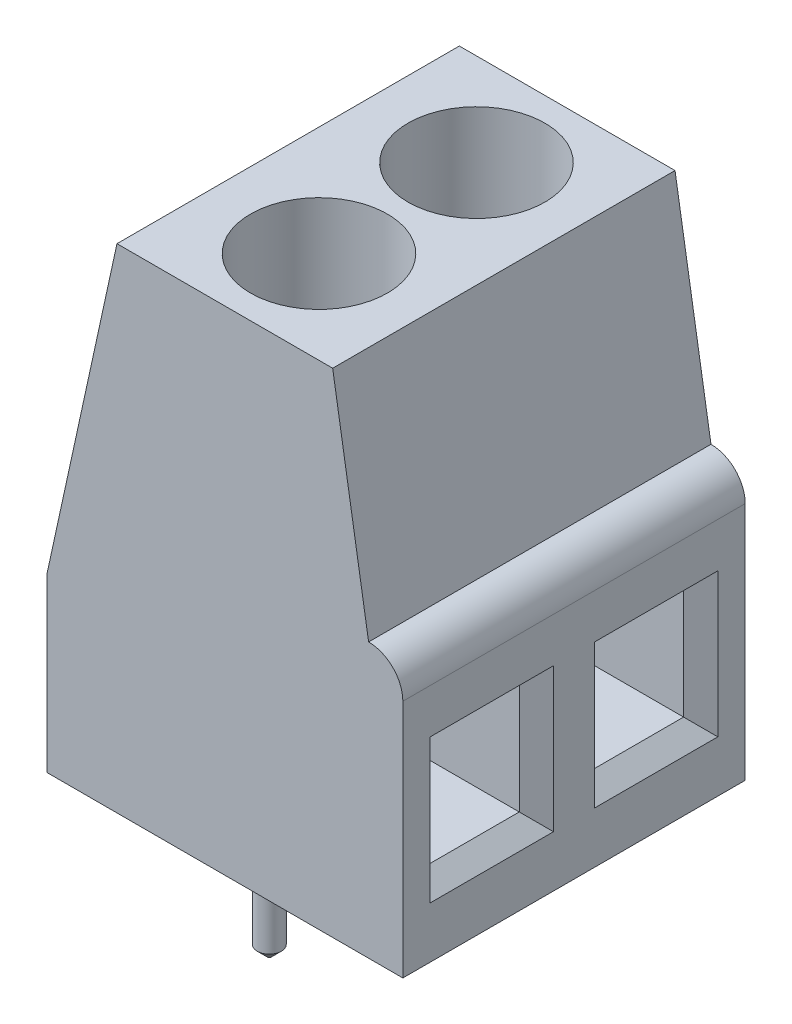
SolidWorks part; units mm, degrees
ref_plane "Plano frontal" through (0, 0, 0) normal (0, 0, 1) x (1, 0, 0)
ref_plane "Plano superior" through (0, 0, 0) normal (0, 1, 0) x (1, 0, 0)
ref_plane "Plano direito" through (0, 0, 0) normal (1, 0, 0) x (0, 0, -1)
sketch "Esboço2" plane through (0, 0, 0) normal (0, 0, 1) x (1, 0, 0)
  line L0 (0, 0) -> (10.4, 0)
  line L2 (0, 0) -> (0, 5)
  line L3 (10.4, 0) -> (10.4, 7)
  line L4 (5.2, 14.4) -> (8.35, 14.4)
  line L5 (2.05, 14.4) -> (0, 5)
  line L7 (5.2, 14.4) -> (2.05, 14.4)
  line L8 (8.35, 14.4) -> (9.4, 8)
  arc A0 (10.4, 7) -> (9.4, 8) centre (9.4, 7) ccw
  dimension "D1" = 10.4
  dimension "D2" = 5
  dimension "D3" = 7
  dimension "D5" = 1
extrude "Ressalto-extrusão2" add sketch "Esboço2" against normal blind 10
sketch "Esboço4" plane through (10.4, 0, 0) normal (1, 0, 0) x (0, 0, -1)
  line L0 (10, 0) -> (10, 7) construction
  line L2 (0, 0) -> (0, 7) construction
  line L5 (1.3, 2) -> (3.9, 2)
  line L6 (1.3, 2) -> (1.3, 5.2)
  line L7 (1.3, 5.2) -> (3.9, 5.2)
  line L8 (3.9, 2) -> (3.9, 5.2)
  line L12 (8.7, 2) -> (6.1, 2)
  line L13 (8.7, 2) -> (8.7, 5.2)
  line L14 (8.7, 5.2) -> (6.1, 5.2)
  line L15 (6.1, 2) -> (6.1, 5.2)
  dimension "D1" = 1.3
  dimension "D2" = 1.3
  dimension "D3" = 3.2
  dimension "D4" = 2.6
  dimension "D7" = 2.6
extrude "Corte-extrusão1" cut sketch "Esboço4" against normal blind 5
chamfer "Chanfro2" distance 0.5 angle 45 4 edges at (10.4, 2, -2.6) (10.4, 3.6, -3.9) (10.4, 5.2, -2.6) (10.4, 3.6, -1.3)
chamfer "Chanfro3" distance 0.5 angle 45 4 edges at (10.4, 3.6, -6.1) (10.4, 2, -7.4) (10.4, 3.6, -8.7) (10.4, 5.2, -7.4)
sketch "Esboço5" plane through (0, 14.4, 0) normal (0, 1, 0) x (1, 0, 0)
  line L0 (2.05, 10) -> (2.05, 0) construction
  line L1 (8.35, 10) -> (2.05, 10) construction
  line L2 (8.35, 0) -> (2.05, 0) construction
  circle A0 centre (5.25, 2.7) radius 2
  circle A1 centre (5.25, 7.3) radius 2
  dimension "D1" = 3.2
  dimension "D4" = 2.7
  dimension "D2" = 3.2
  dimension "D3" = 2.7
extrude "Corte-extrusão2" cut sketch "Esboço5" against normal blind 3
sketch "Esboço10" plane through (0, 0, 0) normal (0, -1, 0) x (1, 0, 0)
  line L0 (0, -10) -> (0, 0) construction
  line L1 (0, 0) -> (10.4, 0) construction
  line L2 (0, -10) -> (10.4, -10) construction
  circle A0 centre (4.3, -2.2) radius 0.35
  circle A1 centre (4.3, -7.8) radius 0.35
  dimension "D1" = 4.3
  dimension "D2" = 4.3
  dimension "D3" = 2.2
  dimension "D4" = 2.2
extrude "Ressalto-extrusão5" add sketch "Esboço10" along normal blind 3.6
chamfer "Chanfro4" distance 0.3 angle 45 2 edges at (4.3, -3.6, -8.15) (4.3, -3.6, -2.55)
